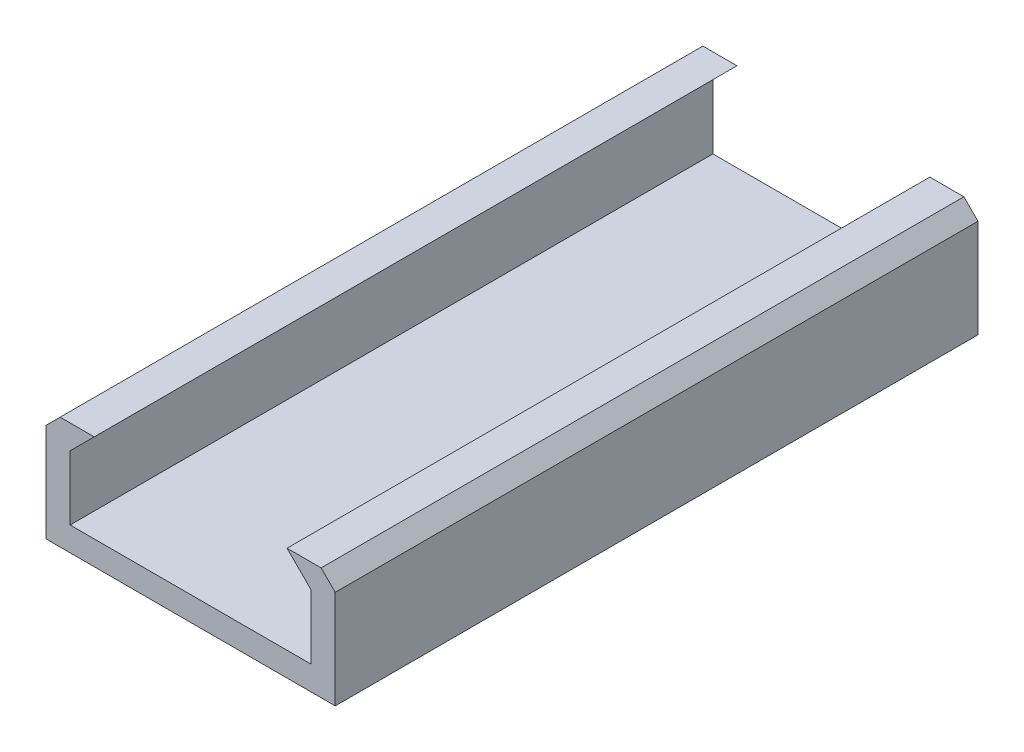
SolidWorks part; units mm, degrees
ref_plane "Front" through (0, 0, 0) normal (0, 0, 1) x (1, 0, 0)
ref_plane "Top" through (0, 0, 0) normal (0, 1, 0) x (1, 0, 0)
ref_plane "Right" through (0, 0, 0) normal (1, 0, 0) x (0, 0, -1)
sketch "Sketch1" plane through (0, 0, 0) normal (0, 0, 1) x (1, 0, 0)
  line L0 (-47.625, 25.4) -> (-38.1, 34.925)
  line L1 (-47.625, 0) -> (-47.625, 25.4)
  line L2 (-47.625, 0) -> (47.625, 0)
  line L3 (-31.848, 34.925) -> (27.098, 34.925) construction
  line L4 (47.625, 0) -> (47.625, 25.4)
  line L5 (38.1, 34.925) -> (47.625, 25.4)
  line L6 (-57.15, 29.3454) -> (-51.5704, 34.925)
  line L7 (-57.15, -9.525) -> (-57.15, 29.3454)
  line L8 (-57.15, -9.525) -> (57.15, -9.525)
  line L9 (57.15, -9.525) -> (57.15, 29.3454)
  line L10 (51.5704, 34.925) -> (57.15, 29.3454)
  line L11 (-51.5704, 34.925) -> (-38.1, 34.925)
  line L13 (38.1, 34.925) -> (51.5704, 34.925)
  dimension "D1" = 34.925
  dimension "D2" = 95.25
  dimension "D3" = 76.2
  dimension "D5" = 45
  dimension "D4" = 45
  dimension "D6" = 9.525
extrude "Base-Extrude" add sketch "Sketch1" against normal blind 254
